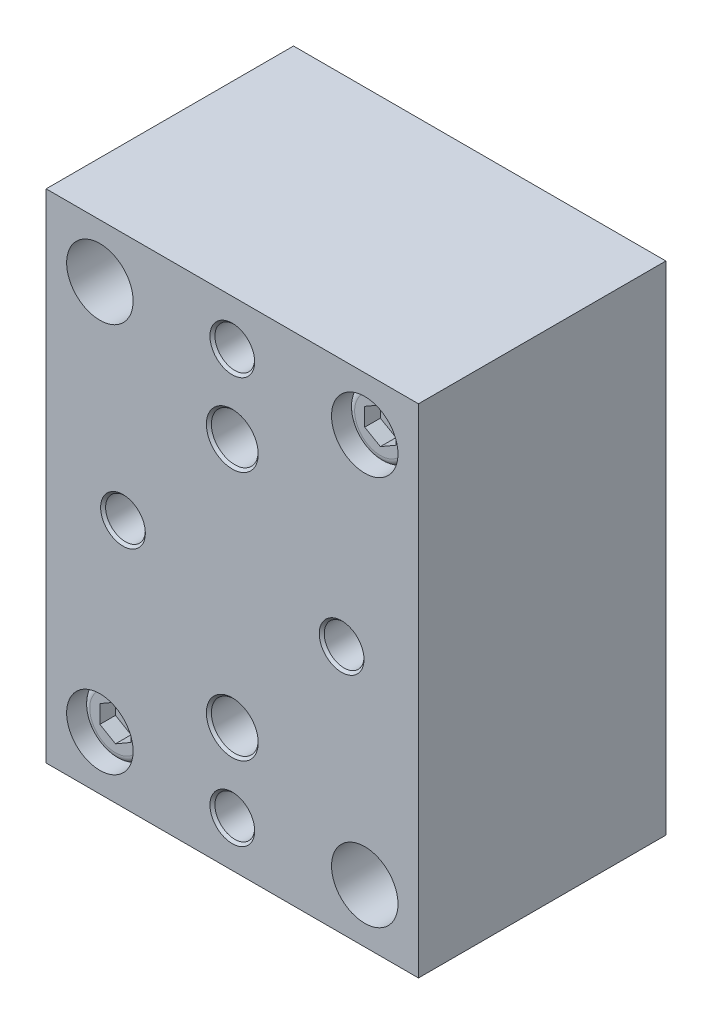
SolidWorks part; units mm, degrees
ref_plane "Front Plane" through (0, 0, 0) normal (0, 0, 1) x (1, 0, 0)
ref_plane "Top Plane" through (0, 0, 0) normal (0, 1, 0) x (1, 0, 0)
ref_plane "Right Plane" through (0, 0, 0) normal (1, 0, 0) x (0, 0, -1)
sketch "Sketch1" plane through (0, 0, 0) normal (0, 0, 1) x (1, 0, 0)
  line L0 (-18.923, 25.273) -> (18.923, -25.273) construction
  line L1 (-18.923, 25.273) -> (18.923, 25.273)
  line L2 (-18.923, 25.273) -> (-18.923, -25.273)
  line L3 (-18.923, -25.273) -> (18.923, -25.273)
  line L4 (18.923, 25.273) -> (18.923, -25.273)
  dimension "D1" = 37.846
  dimension "D2" = 50.546
extrude "Extrude1" add sketch "Sketch1" along normal blind 25.146
sketch "Sketch2" plane through (0, 0, 25.146) normal (0, 0, 1) x (1, 0, 0)
  line L0 (-13.462, 19.812) -> (13.462, -19.812) construction
  circle A0 centre (-13.462, 19.812) radius 3.3782
  circle A1 centre (13.462, 19.812) radius 3.3782
  circle A2 centre (-13.462, -19.812) radius 3.3782
  circle A3 centre (13.462, -19.812) radius 3.3782
  dimension "D1" = 6.7564
  dimension "D2" = 26.924
  dimension "D3" = 39.624
extrude "Cut-Extrude1" cut sketch "Sketch2" against normal through all
hole_wizard "Hole1" positions "Sketch4" profile "Sketch3" legacy
sketch "Sketch4" plane through (0, 0, 0) normal (0, 0, -1) x (-1, 0, 0)
  line L0 (0, 12.7) -> (0, -12.7) construction
  point P0 (0, 12.7)
  point P2 (0, -12.7)
  dimension "D1" = 25.4
sketch "Sketch3" plane through (0, 12.7, 0) normal (1, 0, 0) x (0, 1, 0)
  line L0 (0, 0) -> (0, 25.146)
  line L1 (0, 25.146) -> (2.3813, 25.146)
  line L2 (2.3813, 25.146) -> (2.3813, 3.175)
  line L3 (2.3813, 3.175) -> (2.9845, 3.175)
  line L4 (2.9845, 3.175) -> (2.9845, 0)
  line L5 (2.9845, 0) -> (0, 0)
  line L6 (0, 110) -> (0, -10) construction
  dimension "Diameter" = 4.7625
  dimension "Depth" = 25.146
  dimension "C-Bore Diameter" = 5.969
  dimension "C-Bore Depth" = 3.175
hole_wizard "#10-32 Tapped Hole1" positions "Sketch6" profile "Sketch5" tap size "#10-32" standard "ANSI Inch"
sketch "Sketch6" plane through (0, 0, 25.146) normal (0, 0, 1) x (1, 0, 0)
  line L0 (0, 20.6375) -> (0, -20.6375) construction
  line L2 (-11.1125, 0) -> (11.1125, 0) construction
  point P0 (-11.1125, 0)
  point P2 (11.1125, 0)
  point P4 (0, 20.6375)
  point P6 (0, -20.6375)
  dimension "D1" = 41.275
  dimension "D2" = 22.225
sketch "Sketch5" plane through (-11.1125, 0, 25.146) normal (1, 0, 0) x (0, -1, 0)
  line L0 (0, 0) -> (0, 25.146)
  line L1 (0, 25.146) -> (2.0193, 25.146)
  line L2 (2.0193, 25.146) -> (2.0193, 0)
  line L5 (2.0193, 0) -> (0, 0)
  line L11 (0, -6.35) -> (0, 107.95) construction
  dimension "Thru Tap Drill Dia." = 4.0386
  dimension "Thru Tap Drill Depth" = 25.146
sketch "Sketch7" plane through (0, 0, 0) normal (0, 0, -1) x (-1, 0, 0)
  circle A4 centre (-13.462, 19.812) radius 3.3782 construction
  circle A5 centre (-13.462, 19.812) radius 3.3782
  circle A6 centre (13.462, -19.812) radius 3.3782 construction
  circle A7 centre (13.462, -19.812) radius 3.3782
extrude "Boss-Extrude1" add sketch "Sketch7" against normal offset from surface (23.5585 mm away) 1.5875 separate body
fillet "Fillet1" radius 0.762 1 edges at (16.8402, 19.812, 23.5585)
fillet "Fillet2" radius 0.762 1 edges at (-10.0838, -19.812, 23.5585)
sketch "Sketch8" plane through (0, 0, 23.5585) normal (0, 0, 1) x (1, 0, 0)
  line L1 (13.462, 21.6451) -> (11.8745, 20.7285)
  line L2 (11.8745, 20.7285) -> (11.8745, 18.8955)
  line L3 (11.8745, 18.8955) -> (13.462, 17.9789)
  line L4 (13.462, 17.9789) -> (15.0495, 18.8955)
  line L5 (15.0495, 18.8955) -> (15.0495, 20.7285)
  line L6 (15.0495, 20.7285) -> (13.462, 21.6451)
  line L7 (-13.462, -17.9789) -> (-15.0495, -18.8955)
  line L8 (-15.0495, -18.8955) -> (-15.0495, -20.7285)
  line L9 (-15.0495, -20.7285) -> (-13.462, -21.6451)
  line L10 (-13.462, -21.6451) -> (-11.8745, -20.7285)
  line L11 (-11.8745, -20.7285) -> (-11.8745, -18.8955)
  line L12 (-11.8745, -18.8955) -> (-13.462, -17.9789)
  circle A0 centre (13.462, 19.812) radius 1.5875 construction
  circle A1 centre (-13.462, -19.812) radius 1.5875 construction
  circle A2 centre (13.462, 19.812) radius 2.6162 construction
  circle A3 centre (-13.462, -19.812) radius 2.6162 construction
  dimension "D1" = 3.175
extrude "Cut-Extrude2" cut sketch "Sketch8" against normal blind 1.5875
chamfer "Chamfer1" distance 0.254 angle 45 6 edges at (-9.0932, 0, 25.146) (13.1318, 0, 25.146) (2.0193, -20.6375, 25.146) (-2.3813, -12.7, 25.146) (2.0193, 20.6375, 25.146) (-2.3813, 12.7, 25.146)
